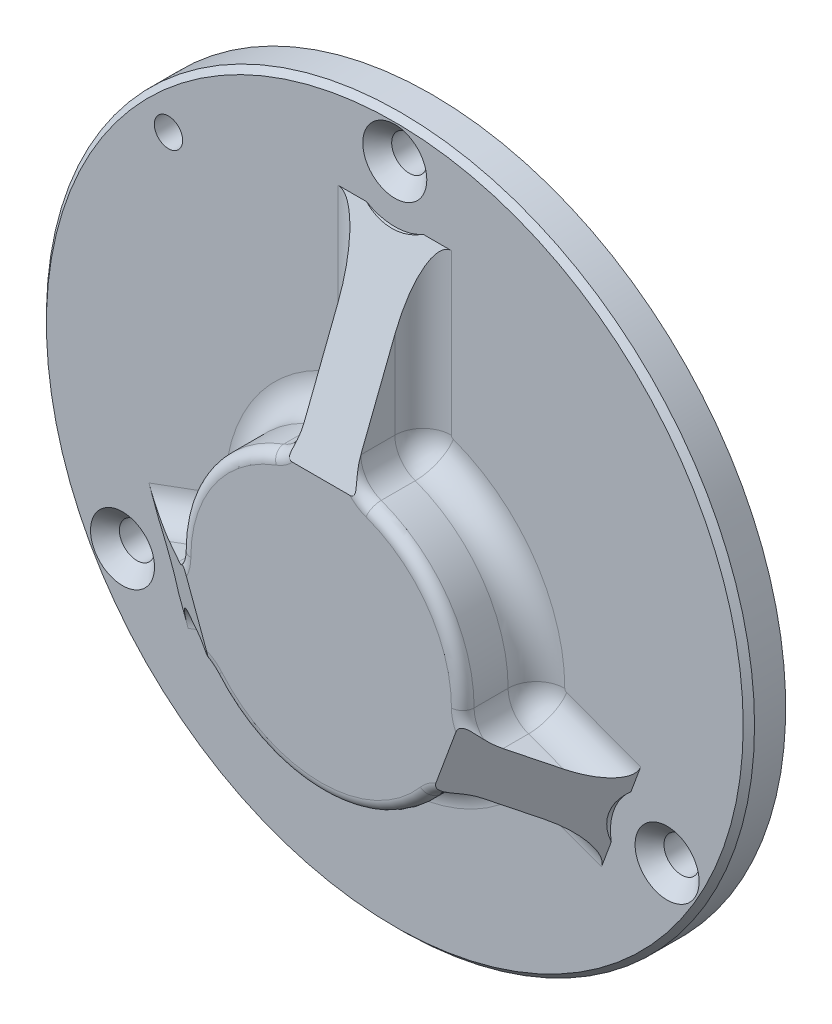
SolidWorks part; units mm, degrees
ref_plane "Plan de face" through (0, 0, 0) normal (0, 0, 1) x (1, 0, 0)
ref_plane "Plan de dessus" through (0, 0, 0) normal (0, 1, 0) x (1, 0, 0)
ref_plane "Plan de droite" through (0, 0, 0) normal (1, 0, 0) x (0, 0, -1)
sketch "Esquisse1" plane through (0, 0, 0) normal (0, 0, 1) x (1, 0, 0)
  circle A0 centre (0, 0) radius 62.5
  dimension "D1" = 125
extrude "Extrusion1" add sketch "Esquisse1" along normal blind 5
sketch "Esquisse2" plane through (0, 0, 5) normal (0, 0, 1) x (1, 0, 0)
  circle A0 centre (0, -10) radius 25
  dimension "D1" = 50
  dimension "D2" = 10
extrude "Extrusion2" add sketch "Esquisse2" along normal blind 13
sketch "Esquisse3" plane through (0, 0, 0) normal (0, 0, -1) x (-1, 0, 0)
  circle A0 centre (0, -10) radius 20
  dimension "D1" = 40
extrude "Enlèv. mat.-Extru.1" cut sketch "Esquisse3" against normal blind 1.5
sketch "Esquisse4" plane through (0, 0, 1.5) normal (0, 0, -1) x (-1, 0, 0)
  circle A0 centre (0, -10) radius 19
  dimension "D1" = 38
extrude "Enlèv. mat.-Extru.2" cut sketch "Esquisse4" against normal blind 7.5
sketch "Esquisse5" plane through (0, 0, 0) normal (0, 0, -1) x (-1, 0, 0)
  circle A0 centre (0, 0) radius 62.5 construction
  circle A1 centre (0, 0) radius 62.5
  circle A2 centre (0, 0) radius 52
  dimension "D1" = 104
extrude "Extrusion3" add sketch "Esquisse5" along normal blind 2
sketch "Esquisse6" plane through (0, 0, 5) normal (0, 0, 1) x (1, 0, 0)
  circle A0 centre (0, 55.5) radius 3.1
  dimension "D1" = 6.2
  dimension "D2" = 55.5
extrude "Enlèv. mat.-Extru.3" cut sketch "Esquisse6" against normal through all
chamfer "Chanfrein2" distance 2.55 angle 45 1 edges at (3.1, 55.5, 5)
pattern_circular "Répétition circulaire1" count 3 over 360 about axis through (0, 0, 0) along (0, 0, 1) of "Enlèv. mat.-Extru.3", "Chanfrein2"
sketch "Esquisse7" plane through (0, 0, -2) normal (0, 0, -1) x (-1, 0, 0)
  circle A0 centre (0, 0) radius 62.5 construction
  circle A1 centre (0, 0) radius 62.5
extrude "Enlèv. mat.-Extru.4" cut sketch "Esquisse7" against normal blind 0.5
ref_plane "Plan1" through (0, 0, 0) normal (0.7071, 0.7071, 0) x (-0.7071, 0.7071, 0)
sketch "Esquisse9" plane through (0, 0, 0) normal (0.7071, 0.7071, 0) x (-0.7071, 0.7071, 0)
  line L0 (56.5, 16.0444) -> (56.5, -13.0547) construction
  line L1 (56.5, 11.9434) -> (59, 10.5)
  line L2 (59, 10.5) -> (59, -1.5)
  line L3 (-62.5, -1.5) -> (62.5, -1.5) construction
  line L4 (56.5, -1.5) -> (59, -1.5)
  line L5 (56.5, 11.9434) -> (56.5, -1.5)
  line L6 (0, 5) -> (0, -1.5) construction
  dimension "D1" = 60
  dimension "D2" = 5
  dimension "D3" = 12
  dimension "D4" = 56.5
revolve "Enlèvement de matière-Révolution1" cut sketch "Esquisse9" angle 360 about L0
sketch "Esquisse10" plane through (0, 0, 5) normal (0, 0, 1) x (1, 0, 0)
  line L0 (0, -10) -> (0, 55.5) construction
  line L2 (-5, 46.8397) -> (-5, 14.4949)
  line L4 (5, 46.8397) -> (5, 14.4949)
  line L5 (0, -10) -> (48.0644, -27.75) construction
  line L6 (0, -10) -> (-48.0644, -27.75) construction
  line L7 (24.7102, -13.7953) -> (41.6726, -20.0595)
  line L8 (21.2459, -23.1761) -> (38.2083, -29.4402)
  line L9 (-24.7102, -13.7953) -> (-41.6726, -20.0595)
  line L10 (-21.2459, -23.1761) -> (-38.2083, -29.4402)
  circle A1 centre (0, -10) radius 25 construction
  arc A2 (-24.7102, -13.7953) -> (-21.2459, -23.1761) centre (0, -10) ccw
  arc A3 (5, 14.4949) -> (-5, 14.4949) centre (0, -10) ccw
  arc A4 (21.2459, -23.1761) -> (24.7102, -13.7953) centre (0, -10) ccw
  arc A5 (-5, 46.8397) -> (5, 46.8397) centre (0, 55.5) ccw
  arc A6 (41.6726, -20.0595) -> (38.2083, -29.4402) centre (48.0644, -27.75) ccw
  arc A7 (-38.2083, -29.4402) -> (-41.6726, -20.0595) centre (-48.0644, -27.75) ccw
  dimension "D7" = 20
  dimension "D8" = 20
  dimension "D9" = 20
  dimension "D1" = 10
  dimension "D2" = 5
  dimension "D3" = 5
  dimension "D4" = 10
  dimension "D5" = 5
  dimension "D6" = 10
extrude "Extrusion4" add sketch "Esquisse10" along normal up to surface (13 mm away)
fillet "Congé1" radius 5.5 6 edges at (-24.7102, -13.7953, 11.5) (-5, 14.4949, 11.5) (5, 14.4949, 11.5) (24.7102, -13.7953, 11.5) (21.2459, -23.1761, 11.5) (-21.2459, -23.1761, 11.5)
sketch "Esquisse14" plane through (5, 0, 0) normal (1, 0, 0) x (0, 0, -1)
  line L0 (-18, 18.6356) -> (-18, 46.8397) construction
  line L1 (-18, 13.4718) -> (-18, 46.8397)
  line L2 (-18, 46.8397) -> (-5, 46.8397) construction
  line L3 (-18, 46.8397) -> (-5, 46.8397)
  line L5 (-18, 13.4718) -> (-5, 46.8397)
  dimension "D1" = 21.286
extrude "Enlèv. mat.-Extru.8" cut sketch "Esquisse14" against normal up to surface (10 mm away)
sketch "Esquisse15" plane through (4.9819, -13.4903, 0) normal (0.3464, -0.9381, 0) x (0.9381, 0.3464, 0)
  line L0 (-46.0412, 18) -> (-32.0999, 18) construction
  line L1 (-46.0412, 18) -> (-26.9361, 18)
  line L2 (-46.0412, 18) -> (-46.0412, 5) construction
  line L3 (-46.0412, 18) -> (-46.0412, 5)
  line L6 (-46.0412, 5) -> (-26.9361, 18)
  dimension "D1" = 34.233
extrude "Enlèv. mat.-Extru.9" cut sketch "Esquisse15" against normal up to surface (10 mm away)
sketch "Esquisse16" plane through (-4.9819, -13.4903, 0) normal (-0.3464, -0.9381, 0) x (0.9381, -0.3464, 0)
  line L0 (32.0999, 18) -> (46.0412, 18) construction
  line L1 (26.9361, 18) -> (46.0412, 18)
  line L2 (46.0412, 18) -> (46.0412, 5) construction
  line L3 (46.0412, 18) -> (46.0412, 5)
  line L6 (26.9361, 18) -> (46.0412, 5)
  dimension "D1" = 34.233
extrude "Enlèv. mat.-Extru.10" cut sketch "Esquisse16" against normal up to surface (10 mm away)
fillet "Congé5" radius 2 9 edges at (25.9836, -13.2093, 18) (20.5124, 4.2913, 18) (-5.9909, 15.4864, 18) (-20.5124, 4.2913, 18) (21.8327, -24.4491, 18) (0, -35, 18) (5.9909, 15.4864, 18) (-25.9836, -13.2093, 18) (-21.8327, -24.4491, 18)
fillet "Congé6" radius 5 5 edges at (31.6693, -27.0254, 5) (21.8327, -24.4491, 5) (0, -35, 5) (-21.8327, -24.4491, 5) (-31.6693, -27.0254, 5)
fillet "Congé7" radius 5 5 edges at (5, 32.7377, 5) (5.9909, 15.4864, 5) (20.5124, 4.2913, 5) (25.9836, -13.2093, 5) (35.1336, -17.6446, 5)
fillet "Congé8" radius 5 5 edges at (-35.1336, -17.6446, 5) (-25.9836, -13.2093, 5) (-20.5124, 4.2913, 5) (-5.9909, 15.4864, 5) (-5, 32.7377, 5)
sketch "Esquisse17" plane through (1.5176, -4.1095, 0) normal (0.3464, -0.9381, 0) x (0.9381, 0.3464, 0)
  line L3 (-26.9361, 18) -> (-27.0009, 18)
  line L4 (-32.0999, 16) -> (-32.0999, 14.4863)
  line L5 (-32.0999, 14.4863) -> (-26.9361, 18)
  line L6 (-26.9361, 18) -> (-27.0009, 18)
  line L7 (-32.0999, 16) -> (-32.0999, 14.4863)
  line L8 (-32.0999, 14.4863) -> (-26.9361, 18)
  spline S1 degree 3 poles (528.5146, -2929.6405) (28.743, -67.1833) (-7.829, 23.2692) (-28.598, 17.7477) (-28.8206, 17.676) (-29.2555, 17.5162) (-29.4687, 17.428) (-55.6037, 5.6559) (-33.5812, -100.6686) (-1483.2482, 2640.8126) knots -11.203791 -11.203791 -11.203791 -11.203791 0.25 0.25 0.375 0.375 0.5 0.5 15.928548 15.928548 15.928548 15.928548 only from (-27.0009, 18) to (-32.0999, 16)
  spline S2 degree 3 poles (-27.0009, 18) (-27.4693, 18) (-27.9253, 17.9265) (-28.598, 17.7477) (-28.8206, 17.676) (-29.2555, 17.5162) (-29.4687, 17.428) (-30.5189, 16.9549) (-31.3088, 16.4771) (-32.0999, 16) knots 0 0 0 0 0.25 0.25 0.375 0.375 0.5 0.5 1 1 1 1
  dimension "D1" = 0
extrude "Enlèv. mat.-Extru.11" cut sketch "Esquisse17" against normal through all and the other way through all
sketch "Esquisse18" plane through (-5, 0, 0) normal (1, 0, 0) x (0, 0, -1)
  line L3 (-15.9882, 18.6356) -> (-16, 18.6356)
  line L4 (-18, 13.5366) -> (-18, 13.4718)
  line L5 (-18, 13.4718) -> (-15.9882, 18.6356)
  line L6 (-15.9882, 18.6356) -> (-16, 18.6356)
  line L7 (-18, 13.5366) -> (-18, 13.4718)
  line L8 (-18, 13.4718) -> (-15.9882, 18.6356)
  spline S1 degree 3 poles (-2640.8308, 1469.7935) (100.6691, 20.1168) (-5.6559, 42.1395) (-17.428, 16.0045) (-17.5162, 15.7912) (-17.676, 15.3564) (-17.7477, 15.1337) (-23.2692, -5.6353) (67.1836, -42.2074) (2929.6547, -541.9814) knots -14.928582 -14.928582 -14.928582 -14.928582 0.5 0.5 0.625 0.625 0.75 0.75 12.20381 12.20381 12.20381 12.20381 only from (-16, 18.6356) to (-18, 13.5366)
  spline S2 degree 3 poles (-16, 18.6356) (-16.4771, 17.8445) (-16.9549, 17.0547) (-17.428, 16.0045) (-17.5162, 15.7912) (-17.676, 15.3564) (-17.7477, 15.1337) (-17.9265, 14.461) (-18, 14.005) (-18, 13.5366) knots 0 0 0 0 0.5 0.5 0.625 0.625 0.75 0.75 1 1 1 1
  dimension "D1" = 0
extrude "Enlèv. mat.-Extru.12" cut sketch "Esquisse18" against normal through all and the other way through all
sketch "Esquisse19" plane through (-4.9819, -13.4903, 0) normal (0.3464, 0.9381, 0) x (0.9381, -0.3464, 0)
  line L3 (26.9361, -18) -> (27.0009, -18)
  line L4 (32.0999, -16) -> (32.0999, -14.4863)
  line L5 (32.0999, -14.4863) -> (26.9361, -18)
  line L6 (26.9361, -18) -> (27.0009, -18)
  line L7 (32.0999, -16) -> (32.0999, -14.4863)
  line L8 (32.0999, -14.4863) -> (26.9361, -18)
  spline S1 degree 3 poles (-528.5146, 2929.6405) (-28.743, 67.1833) (7.829, -23.2692) (28.598, -17.7477) (28.8206, -17.676) (29.2555, -17.5162) (29.4687, -17.428) (55.6037, -5.6559) (33.5812, 100.6686) (1483.2482, -2640.8126) knots -11.203791 -11.203791 -11.203791 -11.203791 0.25 0.25 0.375 0.375 0.5 0.5 15.928548 15.928548 15.928548 15.928548 only from (27.0009, -18) to (32.0999, -16)
  spline S2 degree 3 poles (27.0009, -18) (27.4693, -18) (27.9253, -17.9265) (28.598, -17.7477) (28.8206, -17.676) (29.2555, -17.5162) (29.4687, -17.428) (30.5189, -16.9549) (31.3088, -16.4771) (32.0999, -16) knots 0 0 0 0 0.25 0.25 0.375 0.375 0.5 0.5 1 1 1 1
  dimension "D1" = 0
extrude "Enlèv. mat.-Extru.13" cut sketch "Esquisse19" against normal through all and the other way through all
chamfer "Chanfrein3" distance 1 angle 45 1 edges at (62.5, 0, 5)
sketch "Esquisse20" plane through (0, 0, 5) normal (0, 0, 1) x (1, 0, 0)
  arc A0 (-10, 37.1652) -> (-47.7088, -16.9586) centre (0, -10) ccw construction
  arc A1 (47.7088, -16.9586) -> (10, 37.1652) centre (0, -10) ccw construction
sketch "Esquisse22"
chamfer "Chanfrein4" distance 0.2 angle 45 1 edges at (0, 52, -1.5)
chamfer "Chanfrein5" distance 0.5 angle 45 1 edges at (-19, -10, 1.5)
